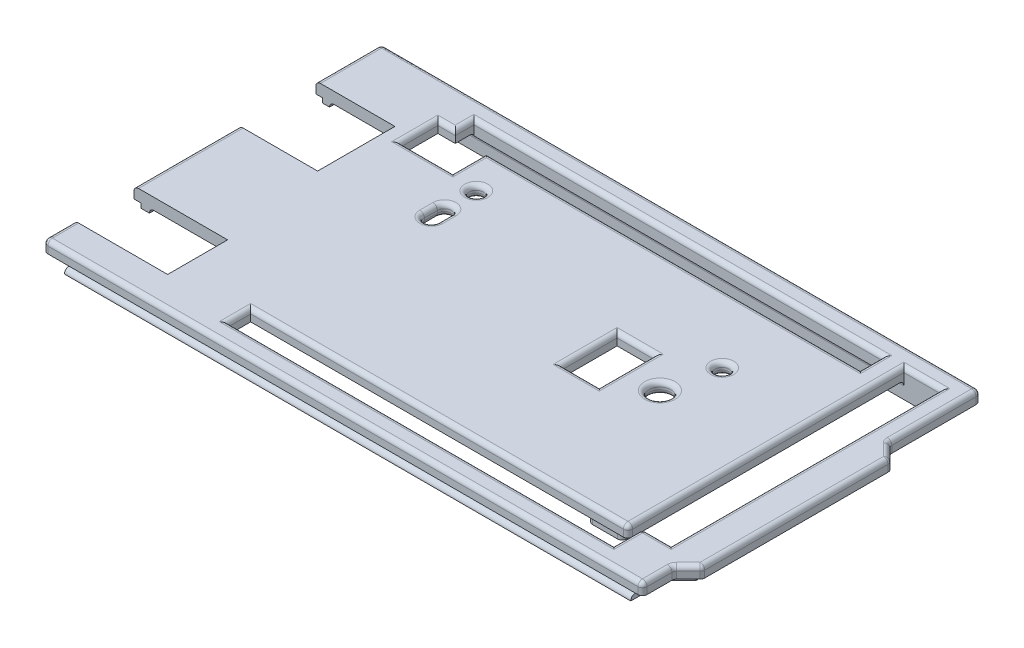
SolidWorks part; units mm, degrees
ref_plane "Front Plane" through (0, 0, 0) normal (0, 0, 1) x (1, 0, 0)
ref_plane "Top Plane" through (0, 0, 0) normal (0, 1, 0) x (1, 0, 0)
ref_plane "Right Plane" through (0, 0, 0) normal (1, 0, 0) x (0, 0, -1)
sketch "Sketch1" plane through (0, 0, 0) normal (0, 1, 0) x (1, 0, 0)
  line L0 (-61.422, -13.8418) -> (43.538, -13.8418)
  line L4 (46.078, -65.0518) -> (43.538, -67.5918)
  line L5 (43.538, -67.5918) -> (43.538, -73.0818)
  line L6 (43.538, -73.0818) -> (-61.422, -73.0818)
  line L7 (-61.422, -73.0818) -> (-61.422, -13.8418)
  line L8 (43.538, -13.8418) -> (43.538, -29.7418)
  line L9 (43.538, -29.7418) -> (46.078, -32.2818)
  line L10 (46.078, -32.2818) -> (46.078, -65.0518)
extrude "Boss-Extrude1" add sketch "Sketch1" along normal blind 2
sketch "Sketch2" plane through (0, 2, 0) normal (0, 1, 0) x (1, 0, 0)
  line L0 (-61.422, -13.8418) -> (-61.422, -73.0818) construction
  line L1 (-61.422, -67.7018) -> (-45.022, -67.7018)
  line L2 (-61.422, -67.7018) -> (-61.422, -57.2018)
  line L3 (-61.422, -57.2018) -> (-45.022, -57.2018)
  line L4 (-45.022, -67.7018) -> (-45.022, -57.2018)
  line L5 (-61.422, -73.0818) -> (43.538, -73.0818) construction
  line L6 (-61.422, -25.3418) -> (-47.572, -25.3418)
  line L7 (-61.422, -25.3418) -> (-61.422, -38.8818)
  line L8 (-61.422, -38.8818) -> (-47.572, -38.8818)
  line L9 (-47.572, -25.3418) -> (-47.572, -38.8818)
  line L10 (43.538, -13.8418) -> (-61.422, -13.8418) construction
  line L11 (43.538, -29.7418) -> (43.538, -13.8418) construction
  line L12 (-32.552, -65.6318) -> (33.548, -65.6318)
  line L13 (-32.552, -65.6318) -> (-32.552, -69.5418)
  line L14 (-32.552, -69.5418) -> (34.988, -69.5418)
  line L15 (34.988, -65.6318) -> (34.988, -69.5418)
  line L16 (39.998, -64.5318) -> (34.988, -64.5318)
  line L17 (39.998, -64.5318) -> (39.998, -17.3118)
  line L18 (39.998, -17.3118) -> (33.548, -17.3118)
  line L19 (33.548, -64.5318) -> (33.548, -17.3118)
  line L20 (-31.902, -33.5618) -> (-31.902, -35.8518)
  line L21 (-41.692, -17.3818) -> (29.908, -17.3818)
  line L22 (-41.692, -17.3818) -> (-41.692, -20.6518)
  line L23 (-35.622, -21.2918) -> (29.908, -21.2918)
  line L24 (29.908, -17.3818) -> (29.908, -21.2918)
  line L25 (-44.742, -20.6518) -> (-41.692, -20.6518)
  line L26 (-44.742, -20.6518) -> (-44.742, -27.1518)
  line L27 (-44.742, -27.1518) -> (-35.622, -27.1518)
  line L28 (-35.622, -21.2918) -> (-35.622, -27.1518)
  line L29 (-29.452, -33.5618) -> (-29.452, -35.8518)
  line L30 (46.078, -65.0518) -> (46.078, -32.2818) construction
  line L31 (3.188, -37.1818) -> (9.688, -37.1818)
  line L32 (3.188, -37.1818) -> (3.188, -46.8018)
  line L33 (3.188, -46.8018) -> (9.688, -46.8018)
  line L34 (9.688, -37.1818) -> (9.688, -46.8018)
  line L35 (34.988, -65.6318) -> (34.988, -64.5318)
  line L36 (33.548, -64.5318) -> (33.548, -65.6318)
  circle A0 centre (-30.677, -27.9718) radius 1.225
  arc A1 (-29.452, -33.5618) -> (-31.902, -33.5618) centre (-30.677, -33.5618) ccw
  arc A2 (-31.902, -35.8518) -> (-29.452, -35.8518) centre (-30.677, -35.8518) ccw
  circle A3 centre (17.718, -33.3018) radius 1.225
  circle A4 centre (15.698, -42.1918) radius 1.875
  point P18 (-32.552, -67.5868)
  point P29 (29.908, -19.3368)
extrude "Cut-Extrude1" cut sketch "Sketch2" against normal blind 2
sketch "Sketch3" plane through (0, 0, 0) normal (0, -1, 0) x (1, 0, 0)
  line L0 (43.538, 13.8418) -> (-61.422, 13.8418) construction
  line L1 (-60.222, 15.0418) -> (42.338, 15.0418)
  line L2 (-60.222, 15.0418) -> (-60.222, 17.3818)
  line L3 (-59.022, 17.3118) -> (39.998, 17.3118)
  line L4 (42.338, 15.0418) -> (42.338, 18.3118)
  line L5 (43.538, 29.7418) -> (43.538, 13.8418) construction
  line L6 (-61.422, 13.8418) -> (-61.422, 25.3418) construction
  line L7 (-61.422, 38.8818) -> (-47.572, 38.8818) construction
  line L8 (-47.572, 25.3418) -> (-61.422, 25.3418) construction
  line L10 (-60.222, 17.3818) -> (-60.222, 25.3418)
  line L11 (-60.222, 25.3418) -> (-59.022, 25.3418)
  line L12 (-59.022, 17.3118) -> (-59.022, 25.3418)
  line L13 (-61.422, 73.0818) -> (43.538, 73.0818) construction
  line L14 (-60.222, 71.8818) -> (40.588, 71.8818)
  line L15 (-60.222, 71.8818) -> (-60.222, 69.5418)
  line L16 (-59.022, 69.5418) -> (40.1778, 69.5418)
  line L18 (-32.552, 69.5418) -> (34.988, 69.5418) construction
  line L19 (-61.422, 67.7018) -> (-61.422, 73.0818) construction
  line L20 (-58.7131, 38.8818) -> (-60.222, 38.8818)
  line L21 (-61.422, 67.7018) -> (-45.022, 67.7018) construction
  line L23 (-60.222, 69.5418) -> (-60.222, 67.7018)
  line L24 (-60.222, 67.7018) -> (-59.022, 67.7018)
  line L25 (-59.022, 69.5418) -> (-59.022, 67.7018)
  line L26 (39.998, 17.3118) -> (33.548, 17.3118) construction
  line L32 (-58.7131, 38.8818) -> (-58.7131, 57.2018)
  line L33 (-58.7131, 57.2018) -> (-60.222, 57.2018)
  line L34 (-60.222, 38.8818) -> (-60.222, 57.2018)
  line L35 (-45.022, 57.2018) -> (-61.422, 57.2018) construction
  line L37 (39.998, 17.3118) -> (39.998, 29.7418)
  line L39 (42.338, 18.3118) -> (42.338, 29.7418)
  line L43 (46.078, 65.0518) -> (46.078, 32.2818) construction
  line L45 (44.878, 32.2818) -> (44.878, 65.0518)
  line L47 (42.7178, 32.2818) -> (42.7178, 65.0518)
  line L50 (42.338, 29.7418) -> (44.878, 32.2818)
  line L52 (42.7178, 32.2818) -> (39.998, 29.7418)
  line L53 (40.588, 71.8818) -> (42.338, 71.8818)
  line L56 (42.338, 71.8818) -> (42.338, 67.5918)
  line L57 (43.538, 73.0818) -> (43.538, 67.5918) construction
  line L58 (44.878, 65.0518) -> (42.338, 67.5918)
  line L59 (42.7178, 65.0518) -> (40.1778, 67.5918)
  line L60 (40.1778, 67.5918) -> (40.1778, 69.5418)
  line L61 (-61.422, 38.8818) -> (-61.422, 57.2018) construction
  point P6 (42.338, 16.6768)
extrude "Boss-Extrude2" add sketch "Sketch3" along normal blind 0.8
fillet "Fillet31" radius 0.8 1 edges at (-61.422, 1, 73.0818)
fillet "Fillet33" radius 0.8 4 edges at (34.988, 2, 67.0368) (0.498, 2, 65.6318) (-32.552, 2, 67.5868) (1.218, 2, 69.5418)
fillet "Fillet35" radius 0.8 8 edges at (34.988, 0.6, 64.5318) (35.2223, 1.7657, 64.5318) (33.548, 0.6, 65.6318) (33.548, 1.7657, 65.3975) (36.773, 2, 17.3118) (39.998, 2, 40.9218) (37.893, 2, 64.5318) (33.548, 2, 41.0718)
fillet "Fillet37" radius 0.8 8 edges at (-43.217, 2, 20.6518) (-40.182, 2, 27.1518) (-35.622, 2, 24.2218) (-41.692, 2, 19.0168) (29.908, 2, 19.3368) (-5.892, 2, 17.3818) (-2.857, 2, 21.2918) (-44.742, 2, 23.9018)
fillet "Fillet38" radius 0.8 4 edges at (-30.677, 2, 32.3368) (-31.902, 2, 34.7068) (-30.677, 2, 37.0768) (-29.452, 2, 34.7068)
fillet "Fillet39" radius 0.8 1 edges at (-30.677, 2, 29.1968)
fillet "Fillet40" radius 0.8 6 edges at (6.438, 2, 37.1818) (3.188, 2, 41.9918) (9.688, 2, 41.9918) (6.438, 2, 46.8018) (15.698, 2, 44.0668) (17.718, 2, 34.5268)
sketch "Sketch6" plane through (0, 0, 0) normal (0, -1, 0) x (1, 0, 0)
  line L0 (46.078, 65.0518) -> (46.078, 32.2818) construction
  line L1 (21.048, 60.1318) -> (26.998, 60.1318)
  line L2 (21.048, 60.1318) -> (21.048, 56.2518)
  line L3 (21.048, 56.2518) -> (26.998, 56.2518)
  line L4 (26.998, 60.1318) -> (26.998, 56.2518)
  line L5 (-60.622, 73.0818) -> (43.538, 73.0818) construction
  line L6 (-61.422, 38.8818) -> (-61.422, 57.2018) construction
  line L7 (-20.332, 46.7518) -> (-26.282, 46.7518)
  line L8 (-20.332, 46.7518) -> (-20.332, 42.8718)
  line L9 (-20.332, 42.8718) -> (-26.282, 42.8718)
  line L10 (-26.282, 46.7518) -> (-26.282, 42.8718)
  point P12 (-26.282, 44.8118)
  point P15 (-20.332, 44.8118)
extrude "Boss-Extrude5" add sketch "Sketch6" along normal blind 6.3
fillet "Fillet44" radius 0.8 8 edges at (24.023, 0, 60.1318) (26.998, 0, 58.1918) (24.023, 0, 56.2518) (21.048, 0, 58.1918) (-23.307, 0, 46.7518) (-26.282, 0, 44.8118) (-20.332, 0, 44.8118) (-23.307, 0, 42.8718)
fillet "Fillet45" radius 0.8 16 edges at (-20.0977, -0.2343, 42.6375) (-26.5163, -0.2343, 42.6375) (-26.5163, -0.2343, 46.9861) (-20.0977, -0.2343, 46.9861) (20.8137, -0.2343, 56.0175) (20.8137, -0.2343, 60.3661) (27.2323, -0.2343, 60.3661) (27.2323, -0.2343, 56.0175) (-20.332, -3.55, 42.8718) (-26.282, -3.55, 42.8718) (-26.282, -3.55, 46.7518) (-20.332, -3.55, 46.7518) (21.048, -3.55, 56.2518) (21.048, -3.55, 60.1318) (26.998, -3.55, 60.1318) (26.998, -3.55, 56.2518)
fillet "Fillet46" radius 0.8 7 edges at (43.538, 1, 67.5918) (46.078, 1, 65.0518) (46.078, 1, 32.2818) (43.538, 1, 29.7418) (-61.422, 1, 13.8418) (43.538, 1, 13.8418) (43.538, 1, 73.0818)
fillet "Fillet49" radius 0.8 18 edges at (-61.422, 2, 19.9918) (43.3037, 2, 72.8475) (43.5989, 2, 67.617) (46.0171, 2, 65.0265) (44.808, 2, 66.3218) (43.5989, 2, 29.7165) (44.808, 2, 31.0118) (46.0171, 2, 32.307) (43.3037, 2, 14.0761) (43.538, 2, 22.0261) (46.078, 2, 48.6668) (43.538, 2, 70.1025) (-8.942, 2, 13.8418) (-61.1877, 2, 14.0761) (-8.942, 2, 73.0818) (-61.1877, 2, 72.8475) (-61.422, 2, 69.9918) (-61.422, 2, 48.0418)
fillet "Fillet50" radius 0.8 7 edges at (17.718, 0, 34.5268) (15.698, 0, 44.0668) (-30.677, 0, 29.1968) (-30.677, 0, 32.3368) (-29.452, 0, 34.7068) (-30.677, 0, 37.0768) (-31.902, 0, 34.7068)
sketch "Sketch7" plane through (0, -0.8, 0) normal (0, -1, 0) x (1, 0, 0)
  line L0 (-59.022, 69.5418) -> (-32.552, 69.5418) construction
  line L1 (-59.0167, 69.5418) -> (40.1778, 69.5418)
  line L2 (-59.0167, 69.5418) -> (-59.0167, 70.9818)
  line L3 (-59.0167, 70.9818) -> (40.1778, 70.9818)
  line L4 (40.1778, 69.5418) -> (40.1778, 70.9818)
  line L5 (39.998, 17.3118) -> (-59.022, 17.3118) construction
  line L6 (-59.022, 17.3118) -> (39.998, 17.3118)
  line L7 (-59.022, 17.3118) -> (-59.022, 15.9418)
  line L8 (-59.022, 15.9418) -> (39.998, 15.9418)
  line L9 (39.998, 17.3118) -> (39.998, 15.9418)
  line L10 (-60.622, 73.0818) -> (42.738, 73.0818) construction
  line L14 (-59.022, 67.7018) -> (-59.022, 69.5418) construction
  line L15 (40.1778, 69.5418) -> (40.1778, 67.5918) construction
  line L16 (42.738, 13.8418) -> (-60.622, 13.8418) construction
extrude "Boss-Extrude6" add sketch "Sketch7" along normal blind 2.1
fillet "Fillet51" radius 0.8 2 edges at (-9.512, -0.8, 15.9418) (-9.4195, -0.8, 70.9818)
sketch "Sketch8" plane through (0, 0, 15.9418) normal (0, 0, -1) x (-1, 0, 0)
  line L0 (59.022, -2.9) -> (59.022, -1.6) construction
  line L1 (-39.998, -2.9) -> (59.022, -2.9)
  line L2 (-39.998, -2.9) -> (-39.998, -2.1)
  line L3 (-39.998, -2.1) -> (59.022, -2.1)
  line L4 (59.022, -2.9) -> (59.022, -2.1)
extrude "Boss-Extrude7" add sketch "Sketch8" along normal blind 0.8
sketch "Sketch9" plane through (0, 0, 70.9818) normal (0, 0, 1) x (1, 0, 0)
  line L0 (40.1778, -2.9) -> (40.1778, -1.6) construction
  line L1 (-59.0167, -2.9) -> (40.1778, -2.9)
  line L2 (-59.0167, -2.9) -> (-59.0167, -2.1)
  line L3 (-59.0167, -2.1) -> (40.1778, -2.1)
  line L4 (40.1778, -2.9) -> (40.1778, -2.1)
extrude "Boss-Extrude8" add sketch "Sketch9" along normal blind 0.8
fillet "Fillet55" radius 0.8 10 edges at (-59.022, 0, 68.6218) (-45.787, 0, 69.5418) (-58.7131, 0, 48.0418) (-59.022, 0, 21.3268) (-12.737, 0, 17.3118) (37.5829, 0, 69.5418) (40.1778, 0, 68.5668) (41.4478, 0, 66.3218) (42.7178, 0, 48.6668) (41.3579, 0, 31.0118)
fillet "Fillet56" radius 0.8 1 edges at (-9.512, -2.1, 15.1418)
fillet "Fillet57" radius 0.8 1 edges at (-9.4195, -2.1, 71.7818)
equation "\"Margen_seguridad\"= 1.5'Margen de seguridad para asegurarnos que quepa perfectamente el arduino"
equation "\"Grosor_punta\"= 0.4'Grosor de la punta de la impresora 3D"
equation "\"Grosor_caja\"= 2'Grosor que queremos tener en la caja"
equation "\"Grosor_cierre\"= 1'Grosor de la raja que tienen las paredes laterales para el cierre"
equation "\"Anchura_cierre\"= 2'Anchura que hay desde la parte de arriba del lateral hasta la mueca para el cierre"
equation "\"Profundidad_cierre\"= 0.8'Profundidad de la mueca para el cierre de la tapa"
equation "\"Grosor_borde\"= 1.2'Grosor de la tapadera de arriba para que no se pueda mover hacia los lados y encaje"
equation "\"Anchura_borde\"= 1.2'Anchura que hay desde el filo de la tapadera al cierre"
equation "\"Altura_soporte\"= 6.3'Altura que hay desde la tapa de arriba para que no se pueda mover hacia los lados y encaje"
equation "\"Curvatura_cierre\"= 0.8'Radio de curvatura de las esquinas para que queden redondeadas"
equation "\"D1@Sketch1\"=53.34+2*\"Grosor_caja\"+\"Margen_seguridad\"+\"Grosor_punta\""
equation "\"D2@Sketch1\"=99.06+2*\"Grosor_caja\"+\"Margen_seguridad\"+\"Grosor_punta\""
equation "\"D3@Sketch1\"=2.54+\"Grosor_caja\"+\"Margen_seguridad\"/2+\"Grosor_punta\"/2"
equation "\"D4@Sketch1\"=2.54"
equation "\"D5@Sketch1\"=2.54"
equation "\"D6@Sketch1\"=12.95+\"Grosor_caja\"+\"Margen_seguridad\"/2+\"Grosor_punta\"/2"
equation "\"D7@Sketch1\"=2.54"
equation "\"D8@Sketch1\"=2.54"
equation "\"D1@Boss-Extrude1\"=\"Grosor_caja\""
equation "\"D1@Sketch2\"=3.18+\"Grosor_caja\"+\"Grosor_punta\"/2"
equation "\"D2@Sketch2\"=9+\"Margen_seguridad\""
equation "\"D3@Sketch2\"=12.7+\"Grosor_caja\"+\"Margen_seguridad\"+\"Grosor_punta\"/2"
equation "\"D4@Sketch2\"=9.3+\"Grosor_caja\"+\"Grosor_punta\"/2"
equation "\"D5@Sketch2\"=12.04+\"Margen_seguridad\""
equation "\"D6@Sketch2\"=10.15+\"Grosor_caja\"+\"Grosor_punta\"/2+\"Margen_seguridad\""
equation "\"D7@Sketch2\"=66.04+\"Margen_seguridad\""
equation "\"D8@Sketch2\"=26.67+\"Grosor_caja\"+\"Grosor_punta\"/2"
equation "\"D9@Sketch2\"=2.41+\"Margen_seguridad\""
equation "\"D10@Sketch2\"=1.34+\"Grosor_caja\"+\"Grosor_punta\"/2"
equation "\"D11@Sketch2\"=1.34+\"Grosor_caja\"+\"Grosor_punta\"/2"
equation "\"D12@Sketch2\"=4.95+\"Margen_seguridad\""
equation "\"D13@Sketch2\"=1.27+\"Grosor_caja\"+\"Grosor_punta\"/2"
equation "\"D14@Sketch2\"=45.72+\"Margen_seguridad\""
equation "\"D15@Sketch2\"=1.34+\"Grosor_caja\"+\"Grosor_punta\"/2"
equation "\"D16@Sketch2\"=2.41+\"Margen_seguridad\""
equation "\"D17@Sketch2\"=70.1+\"Margen_seguridad\""
equation "\"D18@Sketch2\"=17.53+\"Grosor_caja\"+\"Grosor_punta\"/2"
equation "\"D19@Sketch2\"=14.48+\"Grosor_caja\"+\"Grosor_punta\"/2"
equation "\"D20@Sketch2\"=4.61+\"Grosor_caja\"+\"Grosor_punta\"/2"
equation "\"D21@Sketch2\"=5+\"Margen_seguridad\""
equation "\"D22@Sketch2\"=7.62+\"Margen_seguridad\""
equation "\"D23@Sketch2\"=11.18+\"Grosor_caja\"+\"Grosor_punta\"/2+\"Margen_seguridad\"/2"
equation "\"D26@Sketch2\"=1.7+\"Margen_seguridad\"/2"
equation "\"D27@Sketch2\"=1.7+\"Margen_seguridad\"/2"
equation "\"D28@Sketch2\"=1.7+\"Margen_seguridad\"/2"
equation "\"D29@Sketch2\"=24.08+\"Grosor_caja\"+\"Grosor_punta\"/2"
equation "\"D30@Sketch2\"=8.12+\"Margen_seguridad\""
equation "\"D31@Sketch2\"=5+\"Margen_seguridad\""
equation "\"D32@Sketch2\"=34.19+\"Grosor_caja\"+\"Grosor_punta\"/2"
equation "\"D33@Sketch2\"=16.51+\"Grosor_caja\"+\"Margen_seguridad\"/2+\"Grosor_punta\"/2"
equation "\"D34@Sketch2\"=22.87+\"Grosor_caja\"+\"Margen_seguridad\"/2+\"Grosor_punta\"/2"
equation "\"D35@Sketch2\"=1.7+\"Margen_seguridad\"/2"
equation "\"D36@Sketch2\"=27.43+\"Grosor_caja\"+\"Margen_seguridad\"/2+\"Grosor_punta\"/2"
equation "\"D37@Sketch2\"=25.4+\"Grosor_caja\"+\"Margen_seguridad\"/2+\"Grosor_punta\"/2"
equation "\"D38@Sketch2\"=3+\"Margen_seguridad\"/2"
equation "\"D1@Cut-Extrude1\"=\"Grosor_caja\""
equation "\"D1@Sketch3\"=\"Grosor_caja\"/2+\"Grosor_punta\"/2"
equation "\"D2@Sketch3\"=\"Grosor_caja\"/2+\"Grosor_punta\"/2"
equation "\"D3@Sketch3\"=\"D2@Sketch3\""
equation "\"D5@Sketch3\" = \"Grosor_caja\" / 2 + \"Grosor_punta\" / 2"
equation "\"D6@Sketch3\"=\"Grosor_caja\"/2+\"Grosor_punta\"/2"
equation "\"D8@Sketch3\"=\"D3@Sketch3\""
equation "\"D10@Sketch3\"= \"Grosor_caja\" / 2 + \"Grosor_punta\" / 2"
equation "\"D1@Boss-Extrude2\" = \"Anchura_cierre\" / 2 - \"Grosor_punta\" / 2"
equation "\"D1@Fillet3\"=\"Curvatura_cierre\""
equation "\"D1@Fillet10\"=\"Curvatura_cierre\""
equation "\"D1@Fillet12\"=\"Curvatura_cierre\""
equation "\"D1@Fillet13\"=\"Curvatura_cierre\""
equation "\"D1@Fillet16\"=\"Curvatura_cierre\""
equation "\"D1@Fillet29\"=\"Curvatura_cierre\""
equation "\"D1@Fillet31\"=\"Curvatura_cierre\""
equation "\"D1@Fillet33\"=\"Curvatura_cierre\""
equation "\"D1@Fillet35\"=\"Curvatura_cierre\""
equation "\"D1@Fillet38\"=\"Curvatura_cierre\""
equation "\"D1@Fillet39\"=\"Curvatura_cierre\""
equation "\"D1@Fillet37\"=\"Curvatura_cierre\""
equation "\"D1@Fillet40\"=\"Curvatura_cierre\""
equation "\"D1@Sketch6\"=16.13+\"Grosor_caja\"+\"Grosor_punta\"/2+\"Margen_seguridad\"/2"
equation "\"D4@Sketch6\"=3.88"
equation "\"D5@Sketch6\"=32.19+\"Grosor_caja\"+\"Margen_seguridad\"/2+\"Grosor_punta\"/2"
equation "\"D6@Sketch6\"=\"D3@Sketch6\""
equation "\"D1@Boss-Extrude5\"=\"Altura_soporte\""
equation "\"D1@Fillet44\"=\"Curvatura_cierre\""
equation "\"D1@Fillet45\"=\"Curvatura_cierre\""
equation "\"D1@Fillet46\"=\"Curvatura_cierre\""
equation "\"D1@Fillet49\"=\"Curvatura_cierre\""
equation "\"D1@Fillet50\"=\"Curvatura_cierre\""
equation "\"D4@Sketch3\"=\"Grosor_caja\"/2+\"Grosor_punta\"/2"
equation "\"D7@Sketch3\"=\"Grosor_caja\"/2+\"Grosor_punta\"/2"
equation "\"D9@Sketch3\"=\"D3@Sketch3\""
equation "\"D1@Sketch7\"=\"Grosor_caja\"+0.1"
equation "\"D2@Sketch7\"=\"Grosor_caja\"+0.1"
equation "\"D1@Boss-Extrude6\"=\"Anchura_cierre\"/2+\"Grosor_cierre\"+0.1"
equation "\"D1@Fillet51\"=\"Curvatura_cierre\""
equation "\"D1@Sketch8\"=\"Grosor_cierre\"-0.2"
equation "\"D1@Boss-Extrude7\"=\"Profundidad_cierre\""
equation "\"D1@Sketch9\"=\"Grosor_cierre\"-0.2"
equation "\"D1@Boss-Extrude8\"=\"Profundidad_cierre\""
equation "\"D1@Fillet55\"=\"Curvatura_cierre\""
equation "\"D1@Fillet56\"=\"Curvatura_cierre\""
equation "\"D1@Fillet57\"=\"Curvatura_cierre\""
